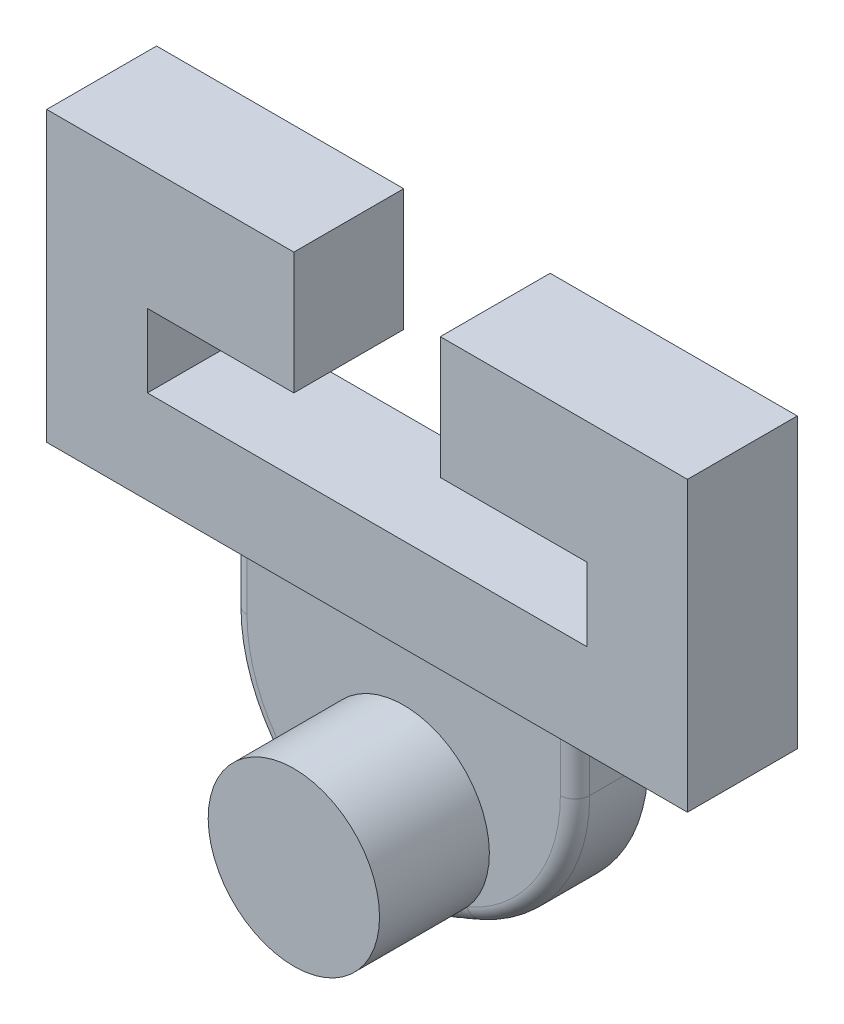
SolidWorks part; units mm, degrees
ref_plane "Front Plane" through (0, 0, 0) normal (0, 0, 1) x (1, 0, 0)
ref_plane "Top Plane" through (0, 0, 0) normal (0, 1, 0) x (1, 0, 0)
ref_plane "Right Plane" through (0, 0, 0) normal (1, 0, 0) x (0, 0, -1)
sketch "Sketch1" plane through (0, 0, 0) normal (0, 0, 1) x (1, 0, 0)
  line L2 (-29.7164, 29.7164) -> (-29.7164, 44.5746)
  line L3 (-29.7164, 44.5746) -> (29.7164, 44.5746)
  line L4 (29.7164, 29.7164) -> (29.7164, 44.5746)
  arc A1 (29.7164, 29.7164) -> (-29.7164, 29.7164) centre (0, 29.7164) cw
  point P0 (0, 44.5746)
extrude "Section B" add sketch "Sketch1" along normal blind 12.7
sketch "Sketch3" plane through (0, 0, 12.7) normal (0, 0, 1) x (1, 0, 0)
  line L1 (0, -17.4625) -> (0, 17.4625) construction
  circle A1 centre (0, 14.8582) radius 14.8582
extrude "Section A" add sketch "Sketch3" along normal blind 19.05
sketch "Sketch4" plane through (0, 0, 0) normal (0, 0, 1) x (1, 0, 0)
  line L0 (0, 14.478) -> (0, 42.8606) construction
  line L2 (-55.5625, 44.5746) -> (55.5625, 44.5746)
  line L3 (-55.5625, 44.5746) -> (-55.5625, 60.7266)
  line L4 (-55.5625, 60.7266) -> (55.5625, 60.7266)
  line L5 (55.5625, 44.5746) -> (55.5625, 60.7266)
  line L6 (29.7164, 44.5746) -> (-29.7164, 44.5746) construction
extrude "Section C" add sketch "Sketch4" along normal blind 19.05
sketch "Sketch5" plane through (0, 0, 0) normal (0, 0, 1) x (1, 0, 0)
  line L0 (0, -17.4625) -> (0, 17.4625) construction
  line L1 (55.5625, 60.7266) -> (38.1, 60.7266)
  line L2 (55.5625, 60.7266) -> (55.5625, 73.4266)
  line L3 (55.5625, 73.4266) -> (38.1, 73.4266)
  line L4 (38.1, 60.7266) -> (38.1, 73.4266)
  line L5 (-55.5625, 73.4266) -> (-38.1, 73.4266)
  line L6 (-38.1, 60.7266) -> (-38.1, 73.4266)
  line L7 (-55.5625, 60.7266) -> (-38.1, 60.7266)
  line L8 (-55.5625, 60.7266) -> (-55.5625, 73.4266)
extrude "Section D" add sketch "Sketch5" along normal blind 19.05
sketch "Sketch6" plane through (0, 0, 0) normal (0, 0, 1) x (1, 0, 0)
  line L0 (0, -17.4625) -> (0, 17.4625) construction
  line L1 (55.5625, 73.4266) -> (12.7, 73.4266)
  line L2 (55.5625, 73.4266) -> (55.5625, 94.5809)
  line L3 (55.5625, 94.5809) -> (12.7, 94.5809)
  line L4 (12.7, 73.4266) -> (12.7, 94.5809)
  line L5 (-55.5625, 94.5809) -> (-12.7, 94.5809)
  line L6 (-12.7, 73.4266) -> (-12.7, 94.5809)
  line L7 (-55.5625, 73.4266) -> (-12.7, 73.4266)
  line L8 (-55.5625, 73.4266) -> (-55.5625, 94.5809)
extrude "Section E" add sketch "Sketch6" along normal blind 19.05
fillet "Design Iteration 1" radius 2.54 7 edges at (-29.7164, 44.5746, 6.35) (29.7164, 44.5746, 6.35) (-29.7164, 37.1455, 12.7) (-21.0127, 8.7037, 12.7) (29.7164, 37.1455, 12.7) (0, 44.5746, 12.7) (21.0127, 8.7037, 12.7)
equation "\"F\"= 250"
equation "\"E\"= 600000"
equation "\"Ts\"= 20000"
equation "\"SF\"= 4"
equation "\"delta\"= 0.005in"
equation "\"Al\"= 0.75in"
equation "\"Ad\"= ( ( 2 * \"F\" * ( ( \"Al\" ) ^ 3 ) * \"SF\" * 64 ) / ( 8 * \"E\" * \"delta\" * pi ) ) ^ ( 1 / 4 ) + 0.25"
equation "\"Bl\"= ( 2 * \"F\" * \"Bh\" * \"SF\" ) / ( \"Bd\" * \"E\" * \"delta\" )"
equation "\"Bh\"= \"Ad\" + ( \"Ad\" / 2 )"
equation "\"Bd\"= 0.5"
equation "\"Dl\"= \"Al\""
equation "\"Dh\"= 0.5in"
equation "\"Dw\"= ( \"F\" * ( ( \"Dl\" ) ^ 3 ) * 12 * \"SF\" ) / ( 8 * \"delta\" * \"E\" * ( \"Dh\" ) ^ 3 ) - 1"
equation "\"Cl\"= \"Al\""
equation "\"Cw\"= 3 + ( 2 * \"Dw\" )"
equation "\"Ch\"= ( ( 2 * \"F\" * ( ( \"Cl\" ) ^ 3 ) * \"SF\" * 12 ) / ( 3 * \"E\" * \"delta\" * \"Cw\" ) ) ^ ( 1 / 3 )"
equation "\"El\"= \"Al\""
equation "\"Ew_calc\"= \"Dw\""
equation "\"Ew\"= \"Ew_calc\" + 1"
equation "\"Eh\"= ( ( \"F\" * ( \"Ew_calc\" ^ 3 ) * 12 * \"SF\" ) / ( 3 * \"E\" * \"delta\" * \"El\" ) ) ^ ( 1 / 3 )"
equation "\"D1@Section B\"=\"Bd\""
equation "\"D1@Sketch3\"=\"Ad\""
equation "\"D1@Section A\"=\"Al\""
equation "\"D1@Sketch4\"=\"Cw\""
equation "\"D2@Sketch4\"=\"Ch\""
equation "\"D1@Section C\"=\"Cl\""
equation "\"D1@Sketch5\"=\"Dh\""
equation "\"D2@Sketch5\"=\"Dw\""
equation "\"D1@Section D\"=\"Dl\""
equation "\"D1@Sketch6\"=\"Eh\""
equation "\"D2@Sketch6\"=\"Ew\""
equation "\"D1@Section E\"=\"El\""
equation "\"D2@Sketch1\"=\"Bh\""
equation "\"D4@Sketch1\"=\"Bl\""
equation "\"D3@Sketch1\"=\"Bh\"-\"Ad\""
